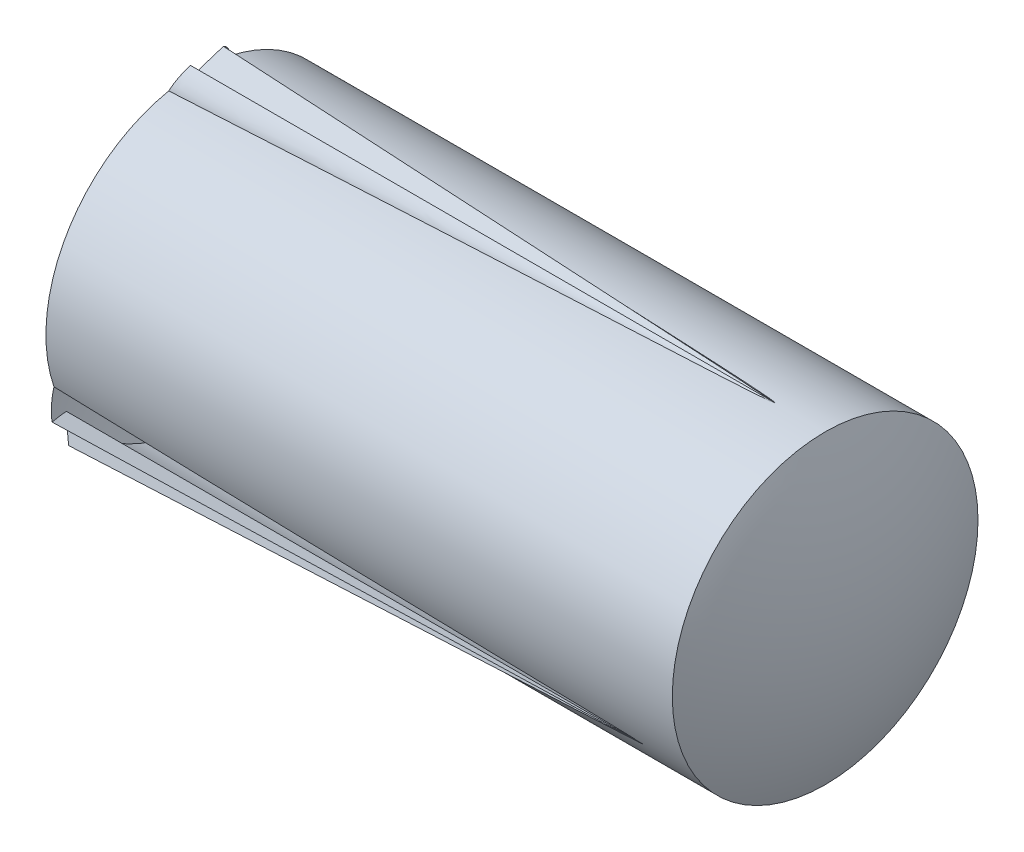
SolidWorks part; units mm, degrees
ref_plane "Plane1" through (0, 0, 0) normal (0, 0, 1) x (1, 0, 0)
ref_plane "Plane2" through (0, 0, 0) normal (0, 1, 0) x (1, 0, 0)
ref_plane "Plane3" through (0, 0, 0) normal (1, 0, 0) x (0, 0, -1)
sketch "BaseSke" plane through (0, 0, 0) normal (0, 0, 1) x (1, 0, 0)
  line L4 (-1.7526, 0) -> (1.7526, 0)
  line L5 (1.5875, 0.7747) -> (-1.5875, 0.7747)
  line L6 (-1.7526, 0) -> (-5.2578, 0) construction
  arc A0 (1.7526, 0) -> (1.5875, 0.7747) centre (-0.1475, 0) ccw
  arc A1 (-1.5875, 0.7747) -> (-1.7526, 0) centre (0.1475, 0) ccw
  point P2 (1.3335, 0.7747)
  point P12 (0, 0.8636)
revolve "Revolve1" add sketch "BaseSke" angle 360 about L6
ref_plane "GrooveMax" through (-1.5875, 0, 0) normal (1, 0, 0) x (0, 0, -1)
ref_plane "GrooveMin" through (1.3335, 0, 0) normal (1, 0, 0) x (0, 0, -1)
sketch "GrooveProfile" plane through (-1.5875, 0, 0) normal (1, 0, 0) x (0, 0, -1)
  line L0 (0.0847, 0.8594) -> (0, 0.7747) construction
  line L1 (0, 0.7747) -> (0, 0) construction
  line L2 (0, 0.7747) -> (-0.0847, 0.8594) construction
  line L3 (0, 0.7747) -> (0, 0) construction
  line L4 (0, 0.7297) -> (-0.152, 0.7596) construction
  line L5 (0, 0.7297) -> (0.152, 0.7596) construction
  circle A0 centre (0, 0) radius 0.8636 construction
  circle A1 centre (0, 0.7297) radius 0.1549
  circle A2 centre (0, 0) radius 0.7747 construction
sketch "GroovePoint" plane through (1.3335, 0, 0) normal (1, 0, 0) x (0, 0, -1)
  circle A1 centre (0, 0.7596) radius 0.0151
  point P0 (0, 0.7596)
loft "Groove" add profiles "GrooveProfile", "GroovePoint"
sketch "Sketch7" plane through (-1.5875, 0, 0) normal (1, 0, 0) x (0, 0, -1)
  line L0 (0, 0.7747) -> (0.0847, 0.8594)
  line L1 (0, 0.7747) -> (-0.0847, 0.8594)
  line L2 (0.0847, 0.8594) -> (0, 0.9442)
  line L3 (-0.0847, 0.8594) -> (0, 0.9442)
extrude "Cut-Extrude1" cut sketch "Sketch7" along normal through all
pattern_circular "CirPattern1" count 3 over 360 about axis through (-1.7526, 0, 0) along (1, 0, 0) of "Groove", "Cut-Extrude1"
sketch "Sketch6" plane through (0, 0, 0) normal (0, 0, 1) x (1, 0, 0)
  line L0 (-1.545, 0.8636) -> (-5.2578, 0.8636)
  line L1 (-5.2578, 0.8636) -> (-5.2578, 0)
  line L2 (-1.7526, 0) -> (-5.2578, 0) construction
  line L3 (-5.2578, 0) -> (-1.7526, 0)
  line L4 (-1.7526, 0) -> (1.7526, 0) construction
  arc A0 (-1.7526, 0) -> (-1.545, 0.8636) centre (0.1475, 0) cw
  arc A1 (-1.5875, 0.7747) -> (-1.7526, 0) centre (0.1475, 0) ccw construction
revolve "Cut-Revolve1" cut sketch "Sketch6" angle 360 about L3
equation "\"D2@GrooveProfile\"=\"Diameter_A@BaseSke\"/5"
